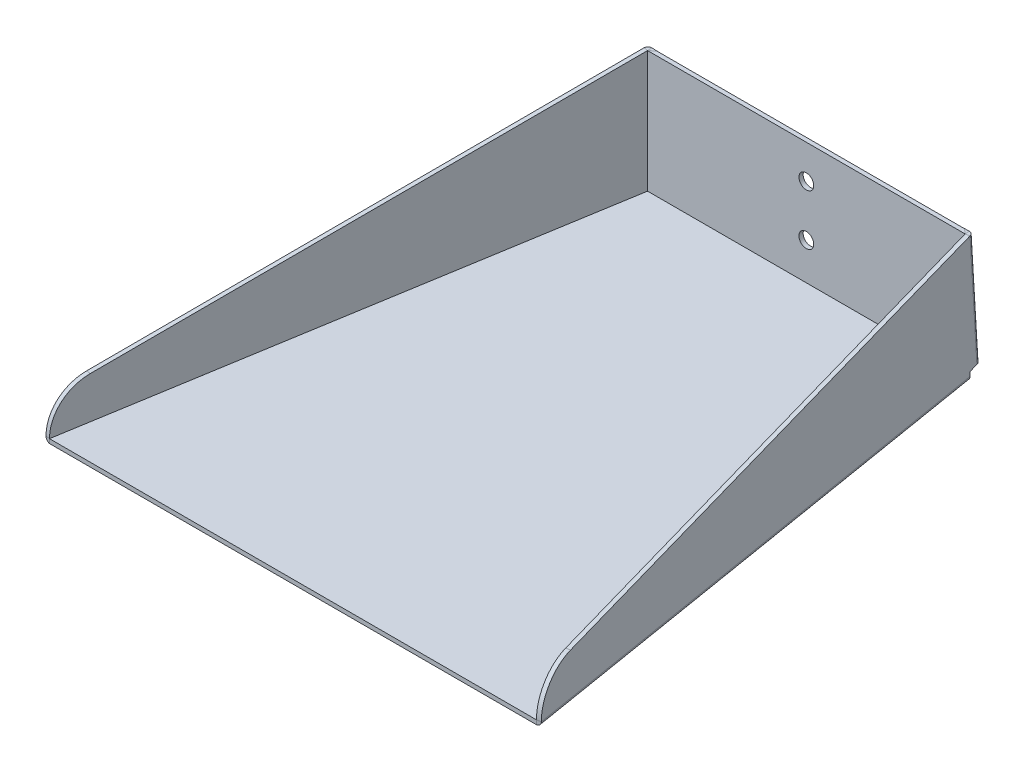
SolidWorks part; units mm, degrees
ref_plane "Front Plane" through (0, 0, 0) normal (0, 0, 1) x (1, 0, 0)
ref_plane "Top Plane" through (0, 0, 0) normal (0, 1, 0) x (1, 0, 0)
ref_plane "Right Plane" through (0, 0, 0) normal (1, 0, 0) x (0, 0, -1)
sketch "Sketch1" plane through (0, 0, 0) normal (0, 1, 0) x (1, 0, 0)
  line L0 (0, 0) -> (115, 0)
  line L1 (115, 0) -> (95, 121.2441) construction
  line L2 (95, 121.2441) -> (20, 121.2441) construction
  line L3 (20, 121.2441) -> (0, 0) construction
  line L4 (57.5, 0) -> (57.5, 121.2441) construction
  line L5 (123.3724, 9.8667) -> (123.3724, 125.9244)
  line L6 (-8.3724, 9.8667) -> (-8.3724, 125.9244)
  line L7 (123.3724, 125.9244) -> (96, 121.4091) construction
  line L8 (-8.3724, 125.9244) -> (19, 121.4091) construction
  line L9 (95, 121.2441) -> (95, 150)
  line L10 (95, 150) -> (20, 150)
  line L11 (20, 121.2441) -> (20, 150)
  line L12 (123.3724, 125.9244) -> (119.3035, 150.591)
  line L13 (-8.3724, 125.9244) -> (-4.3035, 150.591)
  line L14 (19, 121.4091) -> (19, 150)
  line L15 (96, 121.4091) -> (96, 150)
  line L16 (19, 121.2441) -> (19, 150) construction
  line L17 (19, 121.4091) -> (20, 121.2441)
  line L18 (96, 121.2441) -> (96, 150) construction
  line L19 (96, 121.4091) -> (95, 121.2441)
  line L20 (-4.3035, 150.591) -> (19, 150)
  line L21 (119.3035, 150.591) -> (96, 150)
  line L22 (57.5, 121.2441) -> (57.5, 150) construction
  arc A0 (-8.3724, 9.8667) -> (0, 0) centre (1.6276, 9.8667) ccw
  arc A1 (115, 0) -> (123.3724, 9.8667) centre (113.3724, 9.8667) ccw
  circle A2 centre (57.5, 142) radius 1.75
  circle A3 centre (57.5, 130) radius 1.75
  dimension "D3" = 10
  dimension "D13" = 3.5
  dimension "D14" = 8
  dimension "D15" = 12
  dimension "D1" = 115
  dimension "D2" = 75
  dimension "D4" = 90
  dimension "D5" = 90
  dimension "D6" = 150
  dimension "D7" = 90
  dimension "D8" = 90
  dimension "D11" = 25
  dimension "D12" = 25
  dimension "D9" = 1
  dimension "D10" = 1
sheet metal parameters "Sheet-Metal1" thickness 1 parameters "D1"=0.0001
base flange "Base-Flange1" sketch "Sketch1" thickness 1 reverse thickness direction yes parameters "D1"=0.0001
sketch "Sketch3" plane through (0, 1, 0) normal (0, 1, 0) x (1, 0, 0)
  line L0 (20, 121.2441) -> (95, 121.2441)
  line L1 (95, 121.2441) -> (20, 121.2441) construction
sketched bend "Sketched Bend3" parameters "D1"=0.001
bend "SketchBend2" bend radius 0.0001 bend angle 90 parameters "D5"=1
sketch "Sketch5" plane through (0, 1, 0) normal (0, 1, 0) x (1, 0, 0)
  line L2 (-8.3724, 125.9244) -> (19, 123.4091)
  line L3 (19, 121.4091) -> (19, 150) construction
  line L4 (123.3724, 125.9244) -> (96, 123.4091)
  line L5 (96, 150) -> (96, 121.4091) construction
  dimension "D1" = 2
  dimension "D2" = 2
sketched bend "Sketched Bend15" parameters "D1"=0.001
bend "SketchBend22" bend radius 0.001 bend angle 80 parameters "D5"=6
bend "SketchBend23" bend radius 0.001 bend angle 80 parameters "D5"=7
sketch "Sketch6" plane through (0, 1, 0) normal (0, 1, 0) x (1, 0, 0)
  line L0 (20, 121.2441) -> (0, 0)
sketched bend "Sketched Bend16" parameters "D1"=0.001
bend "SketchBend19" bend radius 0.0001 bend angle 90 parameters "D5"=4
sketch "Sketch7" plane through (0, 1, 0) normal (0, 1, 0) x (1, 0, 0)
  line L0 (95, 121.2441) -> (115, 0)
sketched bend "Sketched Bend18" parameters "D1"=0.001
bend "SketchBend21" bend radius 0.001 bend angle 90 parameters "D5"=5
flat pattern "Flat-Pattern1"
sketch "Bend-Lines1" plane through (0, 0, 0) normal (0, 1, 0) x (-1, 0, 0)
bend of the flat pattern "Flatten-<SketchBend2>1"
bend of the flat pattern "Flatten-<SketchBend19>1"
bend of the flat pattern "Flatten-<SketchBend21>1"
bend of the flat pattern "Flatten-<SketchBend22>1"
bend of the flat pattern "Flatten-<SketchBend23>1"
